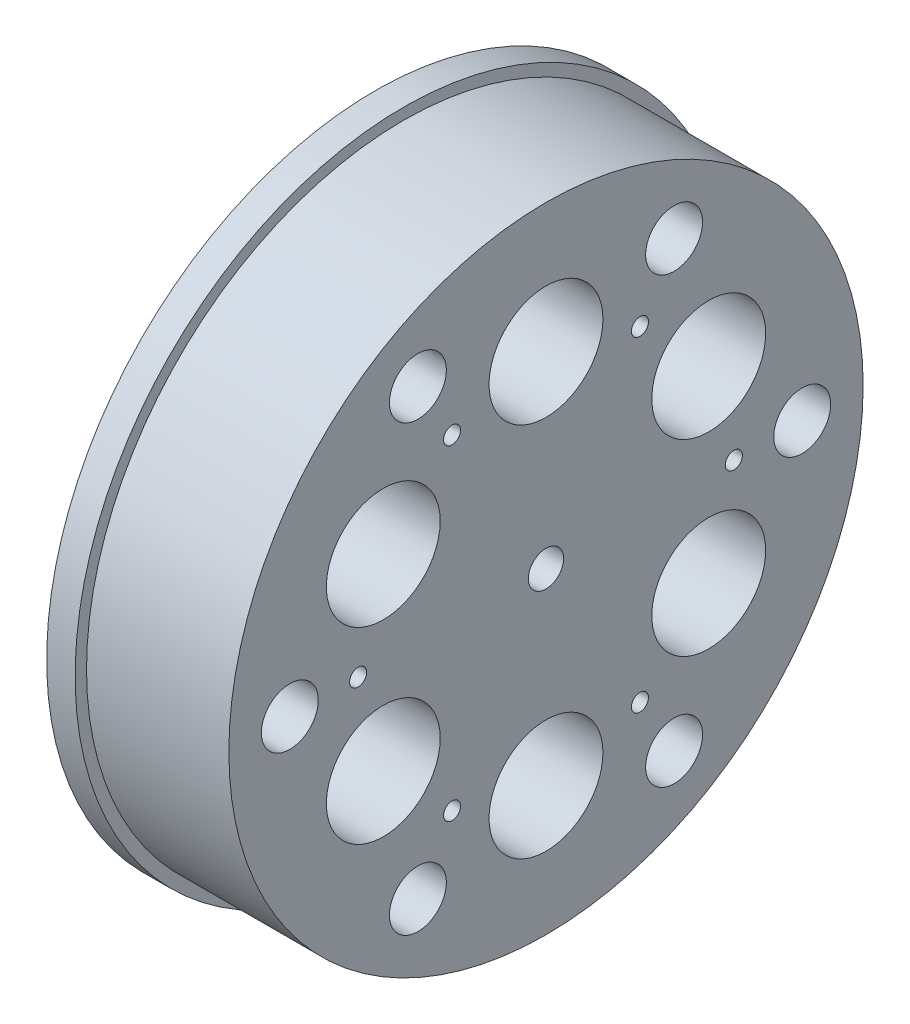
SolidWorks part; units mm, degrees
ref_plane "Plan de face" through (0, 0, 0) normal (0, 0, 1) x (1, 0, 0)
ref_plane "Plan de dessus" through (0, 0, 0) normal (0, 1, 0) x (1, 0, 0)
ref_plane "Plan de droite" through (0, 0, 0) normal (1, 0, 0) x (0, 0, -1)
sketch "Esquisse1" plane through (0, 0, 0) normal (1, 0, 0) x (0, 0, -1)
  line L0 (68.4454, 0) -> (-8.7639, 0) construction
  line L1 (0, -16.7788) -> (0, 145.6709) construction
  circle A0 centre (0, 0) radius 33 construction
  circle A1 centre (0, 0) radius 55.705 construction
  circle A2 centre (0, 0) radius 60.705 construction
  circle A3 centre (0, 0) radius 57.705
  circle A4 centre (0, 33) radius 10
  circle A5 centre (33, 0) radius 1.5
  circle A6 centre (0, 0) radius 12 construction
  circle A7 centre (16.5, -28.5788) radius 1.5
  circle A8 centre (28.5788, 16.5) radius 10
  circle A9 centre (0, 0) radius 3.1
  circle A10 centre (-16.5, -28.5788) radius 1.5
  circle A11 centre (28.5788, -16.5) radius 10
  circle A12 centre (-33, 0) radius 1.5
  circle A13 centre (0, -33) radius 10
  circle A14 centre (-16.5, 28.5788) radius 1.5
  circle A15 centre (-28.5788, -16.5) radius 10
  circle A16 centre (16.5, 28.5788) radius 1.5
  circle A17 centre (-28.5788, 16.5) radius 10
  circle A18 centre (0, 0) radius 45 construction
  circle A19 centre (45, 0) radius 5
  circle A20 centre (22.5, -38.9711) radius 5
  circle A21 centre (-22.5, -38.9711) radius 5
  circle A22 centre (-45, 0) radius 5
  circle A23 centre (-22.5, 38.9711) radius 5
  circle A24 centre (22.5, 38.9711) radius 5
  dimension "D1" = 6
extrude "Boss.-Extru.1" add sketch "Esquisse1" along normal blind 30
sketch "Esquisse2" plane through (30, 0, 0) normal (1, 0, 0) x (0, 0, -1)
  circle A0 centre (0, 0) radius 55.705
  circle A1 centre (0, 0) radius 59.256
extrude "Enlèv. mat.-Extru.1" cut sketch "Esquisse2" against normal blind 25
